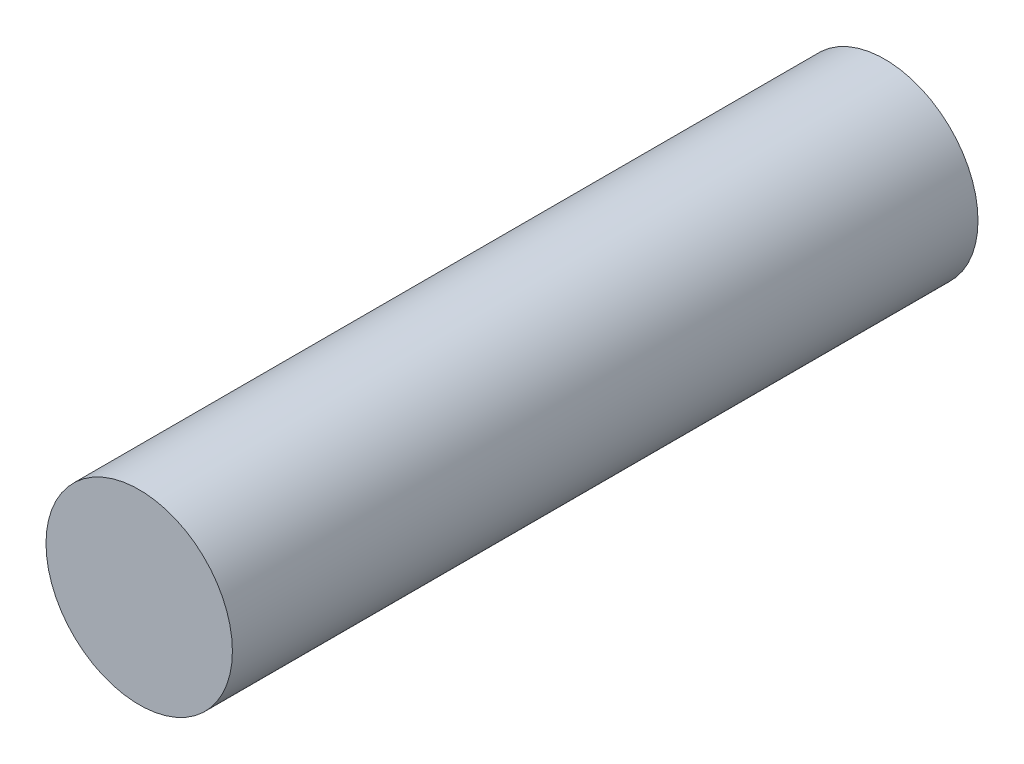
SolidWorks part; units mm, degrees
ref_plane "Plan de face" through (0, 0, 0) normal (0, 0, 1) x (1, 0, 0)
ref_plane "Plan de dessus" through (0, 0, 0) normal (0, 1, 0) x (1, 0, 0)
ref_plane "Plan de droite" through (0, 0, 0) normal (1, 0, 0) x (0, 0, -1)
sketch "Esquisse1" plane through (0, 0, 0) normal (0, 0, 1) x (1, 0, 0)
  circle A0 centre (0, 0) radius 12.5
  dimension "D1" = 25
extrude "Extrusion1" add sketch "Esquisse1" along normal blind 100
ref_point "articulation tige vérin"
